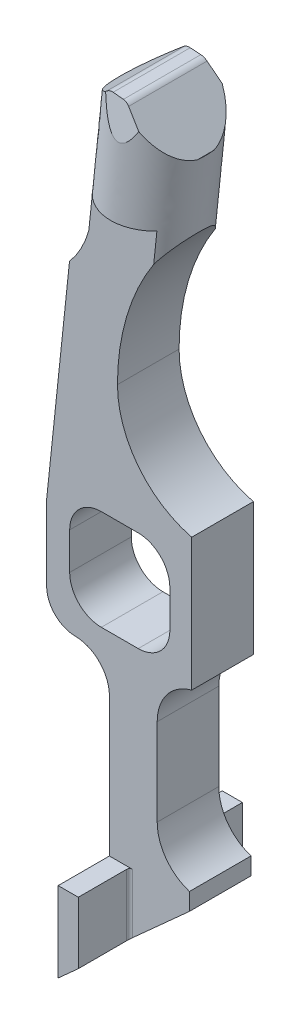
SolidWorks part; units mm, degrees
ref_plane "Front Plane" through (0, 0, 0) normal (0, 0, 1) x (1, 0, 0)
ref_plane "Top Plane" through (0, 0, 0) normal (0, 1, 0) x (1, 0, 0)
ref_plane "Right Plane" through (0, 0, 0) normal (1, 0, 0) x (0, 0, -1)
sketch "Sketch1" plane through (0, 0, 0) normal (0, 0, 1) x (1, 0, 0)
  line L0 (0, 0) -> (3.5306, 3.179)
  line L1 (3.5306, 3.179) -> (3.5306, 3.941)
  line L2 (0, 0) -> (0, 9.6521)
  line L3 (-2.7686, 12.4459) -> (-2.7686, 15.777)
  line L4 (-2.7686, 15.777) -> (-1.056, 32.0709)
  line L5 (2.1082, 5.8794) -> (2.1082, 9.7165)
  line L6 (0, 0) -> (43.4133, 0) construction
  line L7 (0, 0) -> (0, 26.824) construction
  line L8 (3.6322, 11.684) -> (3.6322, 17.5265)
  line L9 (-1.056, 32.0709) -> (0.3598, 33.1453)
  line L10 (-0.3556, 16.51) -> (1.27, 16.51)
  line L11 (-1.7526, 15.113) -> (-1.7526, 13.4874)
  line L12 (-0.3556, 12.0904) -> (1.27, 12.0904)
  line L13 (2.667, 15.113) -> (2.667, 13.4874)
  line L14 (0.3598, 33.1453) -> (1.1191, 33.0814)
  line L15 (1.1191, 33.0814) -> (2.881, 31.0683)
  line L16 (2.881, 31.0683) -> (2.6252, 28.0268)
  line L17 (-0.3556, 15.113) -> (1.27, 13.4874) construction
  line L18 (1.27, 15.113) -> (-0.3556, 13.4874) construction
  line L19 (-0.7719, 28.448) -> (1.4661, 28.448)
  line L20 (1.4661, 28.448) -> (1.245, 25.8194)
  line L21 (-4.7306, 33.5734) -> (1.1084, 33.0823) construction
  line L22 (0.4572, 14.3002) -> (3.6851, 52.6812) construction
  line L23 (1.4172, 41.1727) -> (-0.8673, 14.0084) construction
  line L24 (0.3598, 33.1453) -> (0.0961, 30.0097) construction
  arc A0 (0, 9.6521) -> (-1.5101, 11.176) centre (-1.524, 9.6521) ccw
  arc A1 (-1.5101, 11.176) -> (-2.7686, 12.4459) centre (-1.4986, 12.4459) cw
  arc A2 (3.5306, 3.941) -> (2.1082, 5.8794) centre (4.1402, 5.8794) cw
  arc A3 (2.1082, 9.7165) -> (3.6322, 11.684) centre (4.1402, 9.7165) cw
  arc A4 (3.6322, 17.5265) -> (0.3556, 21.717) centre (4.6736, 21.717) cw
  arc A5 (0.3556, 21.717) -> (2.6252, 28.0268) centre (10.2616, 21.717) cw
  arc A6 (1.27, 12.0904) -> (2.667, 13.4874) centre (1.27, 13.4874) ccw
  arc A7 (2.667, 15.113) -> (1.27, 16.51) centre (1.27, 15.113) ccw
  arc A8 (-0.3556, 16.51) -> (-1.7526, 15.113) centre (-0.3556, 15.113) ccw
  arc A9 (-1.7526, 13.4874) -> (-0.3556, 12.0904) centre (-0.3556, 13.4874) ccw
  arc A10 (-1.7603, 25.3708) -> (-0.7719, 28.448) centre (-4.9459, 28.0913) ccw
  point P31 (2.667, 12.0904)
  point P34 (2.667, 16.51)
  point P42 (0.4572, 14.3002)
  point P54 (0.3471, 28.448)
  point P55 (0.7394, 33.1133)
  dimension "D3" = 2.032
  dimension "D5" = 1.524
  dimension "D6" = 1.27
  dimension "D7" = 0.9652
  dimension "D8" = 9.906
  dimension "D11" = 1.397
  dimension "D15" = 4.318
  dimension "D1" = 48
  dimension "D2" = 0.762
  dimension "D4" = 0.1016
  dimension "D9" = 6
  dimension "D10" = 4.4196
  dimension "D12" = 12.0904
  dimension "D13" = 1.524
  dimension "D14" = 4.826
  dimension "D16" = 5.207
  dimension "D17" = 2.0066
  dimension "D18" = 3.937
  dimension "D19" = 1.016
  dimension "D20" = 5.334
  dimension "D21" = 18.7706
  dimension "D22" = 11.938
  dimension "D23" = 1.2954
  dimension "D24" = 44
  dimension "D25" = 42
  dimension "D26" = 0.762
  dimension "D27" = 1.3208
  dimension "D28" = 7.9248
  dimension "D30" = 2.7686
extrude "Boss-Extrude1" add sketch "Sketch1" along normal mid plane 2.7178 contours A10 L4 A1 A0 L2 L0 L1 A2 L5 A3 L8 A4 A5 L20 L19 A9 L11 A8 L10 A7 L13 A6 L12
sketch "Sketch2" plane through (0, 0, 0) normal (0, 0, 1) x (1, 0, 0)
  line L0 (0.889, 0.8005) -> (0.889, 3.5306)
  line L1 (0, 0) -> (3.5306, 3.179) construction
  line L2 (0.889, 3.5306) -> (0, 3.5306)
  line L3 (0, 0) -> (0, 9.6521) construction
  line L4 (-0.3556, 12.0904) -> (1.27, 12.0904) construction
  line L5 (0, 0) -> (0, 3.5306)
  line L6 (0, 0) -> (0.889, 0.8005)
  dimension "D1" = 0.889
  dimension "D2" = 8.5598
extrude "Boss-Extrude2" add sketch "Sketch2" along normal mid plane 7.239
ref_plane "Plane3" through (0, 25.3708, 0) normal (0, 1, 0) x (-1, 0, 0)
sketch "Sketch3" plane through (-66.8113, 25.3708, 0) normal (0, -1, 0) x (1, 0, 0)
  line L1 (66.1575, -1.3589) -> (68.1592, 1.3589) construction
  line L4 (68.2773, 1.3589) -> (66.0393, -1.3589) construction
  circle A0 centre (67.1583, 0) radius 1.9685
  dimension "D1" = 3.937
extrude "Boss-Extrude3" add sketch "Sketch3" along direction (0.1045, 0.9945, 0) on the side against the normal up to vertex (7.7745 mm away)
sketch "Sketch4" plane through (0, 0, 0) normal (0, 0, 1) x (1, 0, 0)
  line L0 (0.3598, 33.1453) -> (0.3598, 33.9548)
  line L1 (0.3598, 33.9548) -> (4.6047, 33.9548)
  line L2 (4.6047, 33.9548) -> (4.6047, 31.8411)
  line L3 (4.6047, 31.8411) -> (2.881, 31.0683)
  line L4 (2.881, 31.0683) -> (1.1191, 33.0814)
  line L5 (1.1191, 33.0814) -> (0.3598, 33.1453)
  line L6 (0.3556, 21.717) -> (4.4366, 21.717)
  line L7 (4.4366, 21.717) -> (4.4366, 30.2191)
  line L8 (4.4366, 30.2191) -> (2.6252, 28.0268)
  line L9 (-1.056, 32.0709) -> (0.3598, 33.1453)
  line L10 (-1.056, 32.0709) -> (-0.5909, 34.5102)
  line L11 (-0.5909, 34.5102) -> (0.3598, 33.1453)
  arc A0 (2.6252, 28.0268) -> (0.3556, 21.717) centre (10.2616, 21.717) ccw construction
  arc A1 (2.6252, 28.0268) -> (0.3556, 21.717) centre (10.2616, 21.717) ccw
extrude "Cut-Extrude1" cut sketch "Sketch4" against normal mid plane 14.859 contours L11 L10 L9 | L5 L4 L3 L2 L1 L0 | L8 A1 L6 L7
fillet "Fillet1" radius 0.381 2 edges at (1.1191, 33.0814, 0) (0.3598, 33.1453, 0)
sketch "Sketch5" plane through (0, 25.3708, 0) normal (0, -1, 0) x (1, 0, 0)
  line L1 (1.0541, -1.3589) -> (-1.0771, -1.3589) construction
  line L3 (-1.0771, 1.3589) -> (1.0541, 1.3589) construction
  line L4 (1.0541, 1.3589) -> (1.9545, 1.3589)
  line L5 (1.0541, -1.3589) -> (-1.0771, -1.3589)
  line L6 (1.0541, -1.3589) -> (1.9544, -1.3589)
  line L7 (-1.0771, 1.3589) -> (1.0541, 1.3589)
  line L12 (1.0541, -1.3589) -> (1.0541, -1.8372)
  line L13 (0.3556, -1.3589) -> (1.0541, -1.3589)
  line L14 (1.0541, 1.8372) -> (1.0541, 1.3589)
  line L16 (1.0541, 1.3589) -> (0.3556, 1.3589)
  line L17 (0.3556, 1.3589) -> (0.3556, -1.3589)
  line L18 (0.3556, -1.3589) -> (1.0541, -1.3589)
  line L21 (1.0541, 1.3589) -> (0.3556, 1.3589)
  arc A0 (-1.0771, -1.3589) -> (1.0541, -1.8372) centre (0.3471, 0) ccw construction
  arc A1 (1.0541, 1.8372) -> (-1.0771, 1.3589) centre (0.3471, 0) ccw construction
  arc A2 (-1.0771, -1.3589) -> (1.0541, -1.8372) centre (0.3471, 0) ccw
  arc A3 (1.0541, 1.8372) -> (-1.0771, 1.3589) centre (0.3471, 0) ccw
  spline S0 degree 3 poles (1.9545, 1.3589) (1.9372, 1.374) (1.9199, 1.3887) (1.7445, 1.5328) (1.5888, 1.6231) (1.3034, 1.7584) (1.1722, 1.8038) (1.0541, 1.8372) knots 0.736357 0.736357 0.736357 0.736357 0.75 0.75 0.875 0.875 1 1 1 1
  spline S2 degree 3 poles (1.0541, -1.8372) (1.1725, -1.8037) (1.3045, -1.7581) (1.5928, -1.621) (1.7485, -1.5302) (1.9227, -1.3863) (1.9386, -1.3728) (1.9544, -1.3589) knots 0 0 0 0 0.125 0.125 0.25 0.25 0.262503 0.262503 0.262503 0.262503
  spline S3 degree 3 poles (1.0541, -1.8372) (1.1725, -1.8037) (1.3045, -1.7581) (1.5928, -1.621) (1.7485, -1.5302) (1.986, -1.334) (2.0659, -1.2582) (2.2202, -1.0807) (2.295, -0.9784) (2.4266, -0.7457) (2.4853, -0.6115) (2.5674, -0.318) (2.5907, -0.1562) (2.5901, 0.0843) (2.5841, 0.1658) (2.5615, 0.3232) (2.545, 0.3993) (2.482, 0.6204) (2.4237, 0.7522) (2.2225, 1.1039) (2.0608, 1.2729) (1.7445, 1.5328) (1.5888, 1.6231) (1.3034, 1.7584) (1.1722, 1.8038) (1.0541, 1.8372) knots 0 0 0 0 0.125 0.125 0.25 0.25 0.3125 0.3125 0.375 0.375 0.4375 0.4375 0.5 0.5 0.53125 0.53125 0.5625 0.5625 0.625 0.625 0.75 0.75 0.875 0.875 1 1 1 1
  dimension "D1" = 0
extrude "Cut-Extrude2" cut sketch "Sketch5" along direction (0.1045, 0.9945, 0) on the side against the normal up to vertex (3.0772 mm away) contours L4 S0 A3 L7 | S2 L6 M1 | L5 M3 M1 M2
fillet "Fillet2" radius 0.127 2 edges at (0.889, 2.1655, -1.3589) (0.889, 2.1655, 1.3589)
ref_plane "Plane4" through (1.1055, 0, 0) normal (1, 0, 0) x (0, 0, -1)
sketch "Sketch6" plane through (1.1055, 0, 0) normal (1, 0, 0) x (0, 0, -1)
  line L0 (-1.9685, 31.609) -> (-1.5767, 33.8307)
  line L1 (-1.9685, 33.0271) -> (-1.9685, 28.448) construction
  line L2 (-1.3589, 27.1133) -> (-1.3589, 21.717) construction
  line L3 (1.8555, 33.133) -> (-1.8555, 33.133) construction
  line L4 (-1.5767, 33.8307) -> (-2.1817, 33.8307)
  line L5 (-2.1817, 33.8307) -> (-2.1817, 30.3996)
  line L6 (-2.1817, 30.3996) -> (-1.9685, 31.609)
  line L7 (0, 32.9656) -> (0, 24.8237) construction
  line L8 (1.9671, 32.9656) -> (-1.9671, 32.9656) construction
  line L9 (2.1817, 30.3996) -> (1.9685, 31.609)
  line L10 (2.1817, 33.8307) -> (2.1817, 30.3996)
  line L11 (1.5767, 33.8307) -> (2.1817, 33.8307)
  line L12 (1.9685, 31.609) -> (1.5767, 33.8307)
  point P8 (-1.6998, 33.133)
  point P20 (1.6998, 33.133)
  dimension "D1" = 10
  dimension "D2" = 1.524
extrude "Cut-Extrude3" cut sketch "Sketch6" against normal mid plane 22.479
